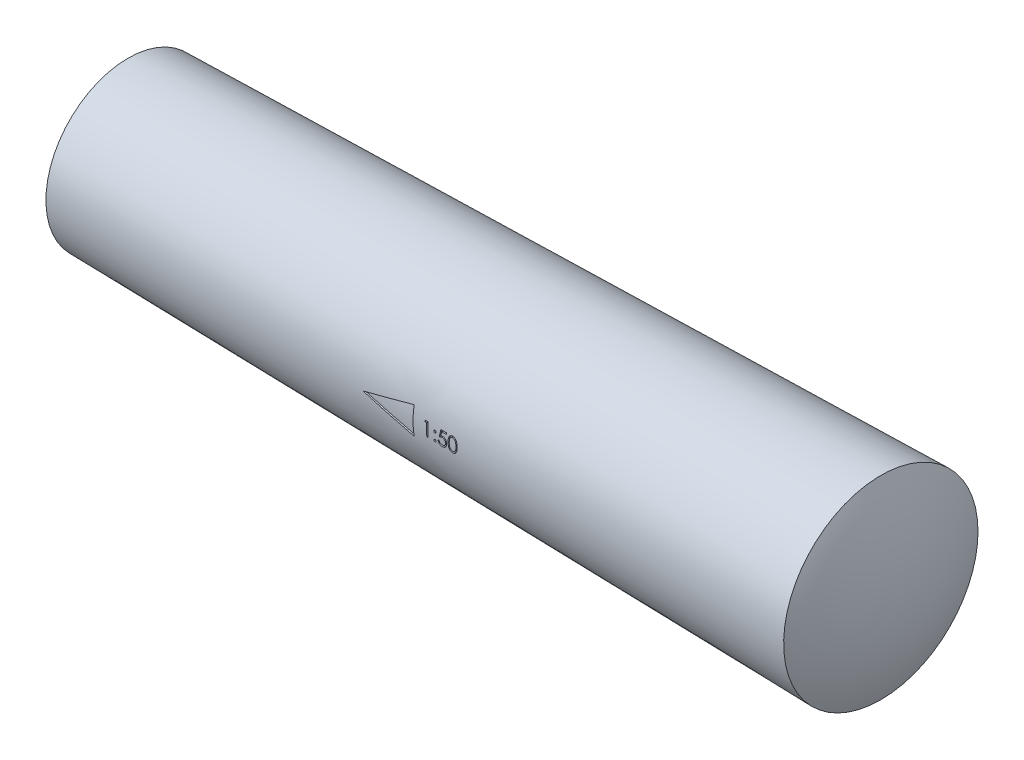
SolidWorks part; units mm, degrees
ref_plane "Front Plane" through (0, 0, 0) normal (0, 0, 1) x (1, 0, 0)
ref_plane "Top Plane" through (0, 0, 0) normal (0, 1, 0) x (1, 0, 0)
ref_plane "Right Plane" through (0, 0, 0) normal (1, 0, 0) x (0, 0, -1)
sketch "Sketch1" plane through (0, 0, 0) normal (1, 0, 0) x (0, 0, -1)
  circle A0 centre (0, 0) radius 6
  dimension "D1" = 12
extrude "Extrude1" add sketch "Sketch1" along normal mid plane 55
draft "Draft1" type of draft neutral plane draft angle 1.146 faces to draft 1 parameters "D1"=1.146
sketch "Sketch2" plane through (0, 0, 0) normal (0, 0, 1) x (1, 0, 0)
  line L0 (-27.5, 0) -> (-27.5, 6)
  line L1 (-27.5, 6) -> (-27.5, -6) construction
  line L2 (-27.5, 0) -> (-29.1, 0)
  line L3 (-29.1, 0) -> (-29.1, -6.55) construction
  line L4 (27.5, 0) -> (27.5, 7.1)
  line L5 (27.5, -7.1) -> (27.5, 7.1) construction
  line L6 (27.5, 0) -> (29.1, 0)
  line L7 (29.1, 0) -> (29.1, -6.55) construction
  line L8 (-27.5, -6) -> (27.5, -7.1) construction
  arc A0 (-29.1, 0) -> (-27.5, 6) centre (-17.05, 0) cw
  arc A1 (29.1, 0) -> (27.5, 7.1) centre (12.5467, 0) ccw
  point P14 (0, -6.55)
revolve "Revolve1" add sketch "Sketch2" angle 360 about L2
sketch "Sketch5" plane through (0, 0, 0) normal (0, 0, 1) x (1, 0, 0)
  line L0 (0, 6.55) -> (0, -6.55) construction
  line L1 (27.5, 7.1) -> (-27.5, 6) construction
  line L2 (-27.5, -6) -> (27.5, -7.1) construction
ref_plane "Plane2" through (0, 0, 0) normal (-0.02, 0, 0.9998) x (0.9998, 0, 0.02)
sketch "Sketch6" plane through (0, 0, 0) normal (-0.02, 0, 0.9998) x (0.9998, 0, 0.02)
  line L0 (0, 0) -> (0, 1)
  line L1 (0, 6.55) -> (0, -6.55) construction
  line L2 (0, 1) -> (-3.7321, 0)
  line L3 (-3.7321, 0) -> (0, -1)
  line L4 (0, -1) -> (0, 0)
  line L5 (0, -0.5) -> (4, -0.5) construction
  text T0 "1:50" font "Century Gothic" height 1
  dimension "D1" = 2
  dimension "D2" = 30
  dimension "D3" = 4
wrap "Wrap2" sketch "Sketch6" wrap type deboss source sketch "Sketch6" thickness 0.1 parameters "D1"=0.1
equation "\"D2@Sketch2\" = \"D1@Sketch2\""
